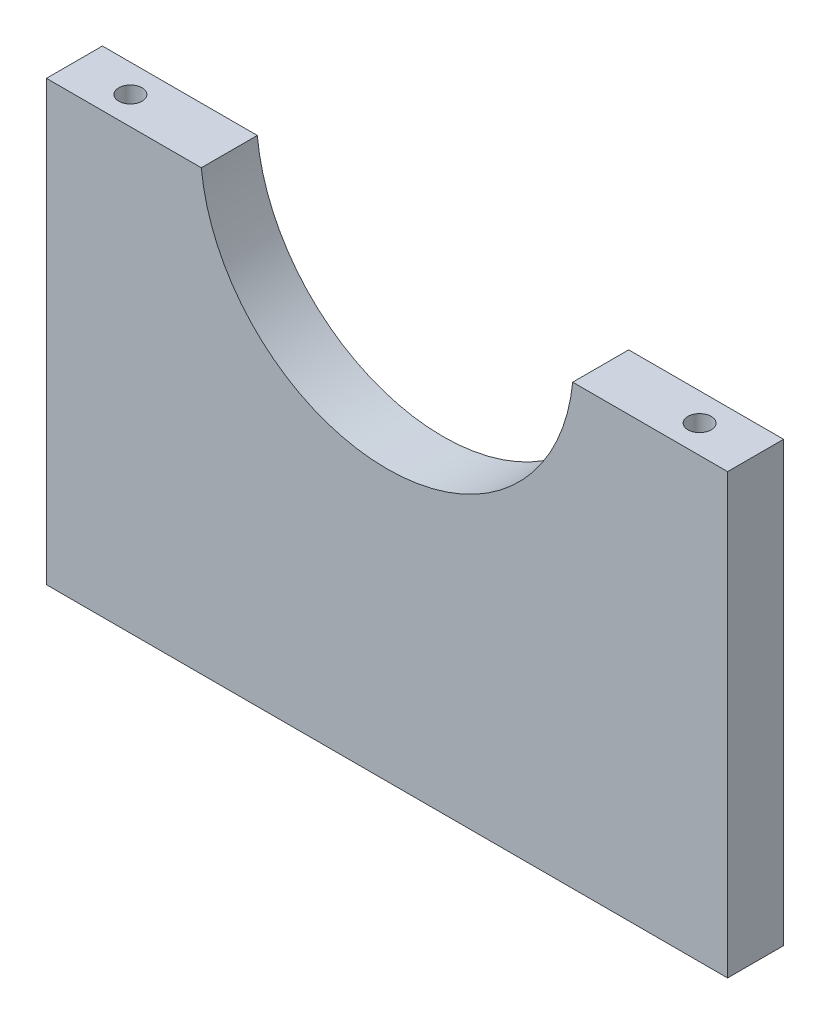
SolidWorks part; units mm, degrees
ref_plane "Front Plane" through (0, 0, 0) normal (0, 0, 1) x (1, 0, 0)
ref_plane "Top Plane" through (0, 0, 0) normal (0, 1, 0) x (1, 0, 0)
ref_plane "Right Plane" through (0, 0, 0) normal (1, 0, 0) x (0, 0, -1)
sketch "Sketch1" plane through (0, 0, 0) normal (0, 0, 1) x (1, 0, 0)
  line L0 (39.7995, 47) -> (73, 47)
  line L1 (-73, -47) -> (73, -47)
  line L2 (-73, -47) -> (-73, 47)
  line L3 (-73, 47) -> (-39.7995, 47)
  line L4 (73, -47) -> (73, 47)
  line L5 (-73, -47) -> (73, 47) construction
  line L6 (-73, 47) -> (73, -47) construction
  arc A0 (-39.7995, 47) -> (39.7995, 47) centre (0, 51) ccw
  point P0 (0, 0)
  point P7 (0, 0)
  point P10 (0, 55.9513)
  dimension "D3" = 80
  dimension "D1" = 94
  dimension "D2" = 146
  dimension "D4" = 4
extrude "Boss-Extrude1" add sketch "Sketch1" along normal blind 12
hole_wizard "M6x1.0 Tapped Hole1" positions "3DSketch1" profile "Sketch2" tap size "M6x1.0" standard "ANSI Metric"
sketch3d "3DSketch1"
  line L0 (-73, 47, 12) -> (-73, 47, 0) construction
  line L1 (-39.7995, 47, 0) -> (-73, 47, 0) construction
  line L2 (73, 47, 12) -> (73, 47, 0) construction
  line L3 (73, 47, 0) -> (39.7995, 47, 0) construction
  point P0 (-61, 47, 6)
  point P10 (61, 47, 6)
  dimension "D1" = 12
  dimension "D2" = 6
  dimension "D3" = 12
  dimension "D4" = 6
sketch "Sketch2" plane through (-61, 47, 6) normal (1, 0, 0) x (0, 0, 1)
  line L0 (0, 0) -> (0, 22.5)
  line L1 (0, 22.5) -> (2.5, 20.9978)
  line L2 (2.5, 20.9978) -> (2.5, 0)
  line L5 (2.5, 0) -> (0, 0)
  line L10 (0, 22.5) -> (-2.5, 20.9978) construction
  line L11 (0, -6.35) -> (0, 107.95) construction
  dimension "Tap Drill Dia." = 5
  dimension "Tap Drill Depth" = 22.5
  dimension "Drill Angle" = 118
hole_wizard "M8x1.0 Tapped Hole1" positions "3DSketch3" profile "Sketch3" tap size "M8x1.0" standard "ANSI Metric"
sketch3d "3DSketch3"
  line L0 (73, -47, 12) -> (73, -47, 0) construction
  line L1 (-73, -47, 0) -> (73, -47, 0) construction
  point P0 (-61, -47, 6)
  point P2 (61, -47, 6)
  dimension "D1" = 122
  dimension "D2" = 12
  dimension "D3" = 6
  dimension "D4" = 6
sketch "Sketch3" plane through (-61, -47, 6) normal (1, 0, 0) x (0, 0, -1)
  line L0 (0, 0) -> (0, 28.103)
  line L1 (0, 28.103) -> (3.5, 26)
  line L2 (3.5, 26) -> (3.5, 0)
  line L5 (3.5, 0) -> (0, 0)
  line L10 (0, 28.103) -> (-3.5, 26) construction
  line L11 (0, -6.35) -> (0, 107.95) construction
  dimension "Tap Drill Dia." = 7
  dimension "Tap Drill Depth" = 26
  dimension "Drill Angle" = 118
